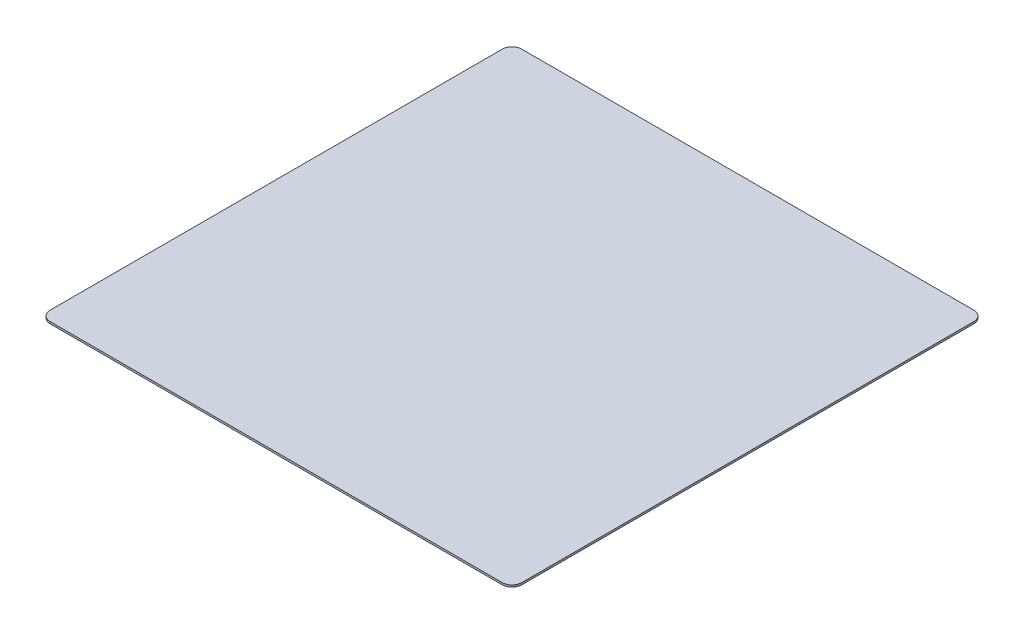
SolidWorks part; units mm, degrees
ref_plane "Front Plane" through (0, 0, 0) normal (0, 0, 1) x (1, 0, 0)
ref_plane "Top Plane" through (0, 0, 0) normal (0, 1, 0) x (1, 0, 0)
ref_plane "Right Plane" through (0, 0, 0) normal (1, 0, 0) x (0, 0, -1)
sketch "Sketch1" plane through (0, 0, 0) normal (0, 1, 0) x (1, 0, 0)
  line L1 (-12.226, -18.993) -> (11.904, -18.993)
  line L2 (-12.226, -18.993) -> (-12.226, 5.137)
  line L3 (-12.226, 5.137) -> (11.904, 5.137)
  line L4 (11.904, -18.993) -> (11.904, 5.137)
  dimension "D1" = 24.13
  dimension "D2" = 24.13
extrude "Boss-Extrude1" add sketch "Sketch1" along normal blind 0.1
fillet "Fillet1" radius 0.5 4 edges at (11.904, 0.05, -5.137) (11.904, 0.05, 18.993) (-12.226, 0.05, -5.137) (-12.226, 0.05, 18.993)
